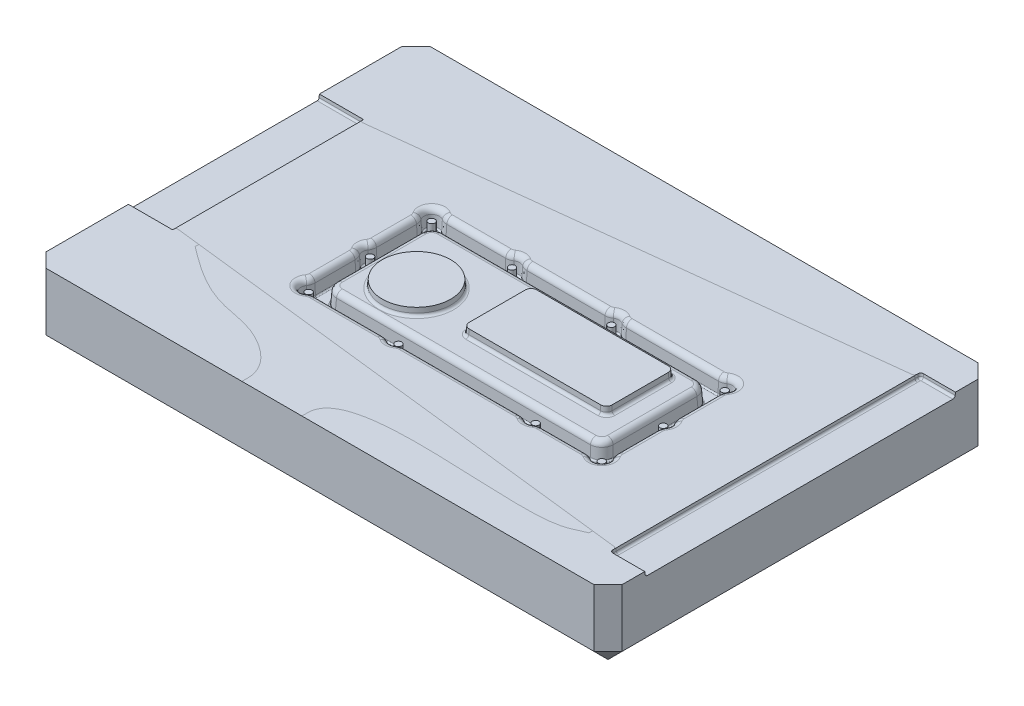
SolidWorks part; units mm, degrees
ref_plane "Front Plane" through (0, 0, 0) normal (0, 0, 1) x (1, 0, 0)
ref_plane "Top Plane" through (0, 0, 0) normal (0, 1, 0) x (1, 0, 0)
ref_plane "Right Plane" through (0, 0, 0) normal (1, 0, 0) x (0, 0, -1)
sketch "Sketch1" plane through (0, 0, 0) normal (0, 1, 0) x (1, 0, 0)
  line L5 (-304.8, 203.2) -> (304.8, 203.2)
  line L6 (-304.8, 203.2) -> (-304.8, -203.2)
  line L7 (-304.8, -203.2) -> (304.8, -203.2)
  line L8 (304.8, 203.2) -> (304.8, -203.2)
  line L9 (-304.8, 203.2) -> (304.8, -203.2) construction
  line L10 (-304.8, -203.2) -> (304.8, 203.2) construction
  point P0 (0, 0)
  dimension "D1" = 406.4
  dimension "D2" = 609.6
extrude "Boss-Extrude1" add sketch "Sketch1" against normal blind 76.2
sketch "Sketch4" plane through (0, 0, 0) normal (0, 1, 0) x (1, 0, 0)
  line L1 (152.0862, 42.0476) -> (-123.5031, 42.0476)
  line L2 (152.0862, 42.0476) -> (152.0862, -68.9356)
  line L3 (152.0862, -68.9356) -> (-123.5031, -68.9356)
  line L4 (-123.5031, 42.0476) -> (-123.5031, -68.9356)
extrude "Boss-Extrude2" add sketch "Sketch4" along normal blind 10
other "Cavity1"
other "die_demo_2020-2<3>@die_demo-a2"
sketch "Sketch5" plane through (0, 10, 0) normal (0, 1, 0) x (1, 0, 0)
  line L4 (152.0862, -68.9356) -> (152.0862, 42.0476)
  line L5 (152.0862, 42.0476) -> (-123.5031, 42.0476)
  line L6 (-123.5031, 42.0476) -> (-123.5031, -68.9356)
  line L7 (-123.5031, -68.9356) -> (152.0862, -68.9356)
  line L8 (152.0862, -68.9356) -> (152.0862, 42.0476)
  line L9 (152.0862, 42.0476) -> (-123.5031, 42.0476)
  line L10 (-123.5031, 42.0476) -> (-123.5031, -68.9356)
  line L11 (-123.5031, -68.9356) -> (152.0862, -68.9356)
  dimension "D1" = 0
extrude "Cut-Extrude3" cut sketch "Sketch5" against normal up to surface (2 mm away)
sketch "Sketch2" plane through (-270, 0, 0) normal (1, 0, 0) x (0, 0, -1)
  line L7 (-101.0245, 0) -> (-100.6872, -3.2091)
  line L8 (-98.6982, -5) -> (98.6982, -5)
  line L9 (100.6872, -3.2091) -> (101.0245, 0)
  line L10 (101.0245, 0) -> (98.318, 0)
  line L11 (91.6098, 0) -> (3.3541, 0)
  line L12 (-3.3541, 0) -> (-91.6098, 0)
  line L13 (-98.318, 0) -> (-101.0245, 0)
  line L21 (-101.0245, 0) -> (-100.6872, -3.2091)
  line L22 (-98.6982, -5) -> (98.6982, -5)
  line L23 (100.6872, -3.2091) -> (101.0245, 0)
  line L24 (101.0245, 0) -> (98.318, 0)
  line L25 (91.6098, 0) -> (3.3541, 0)
  line L26 (-3.3541, 0) -> (-91.6098, 0)
  line L27 (-98.318, 0) -> (-101.0245, 0)
  arc A5 (-100.6872, -3.2091) -> (-98.6982, -5) centre (-98.6982, -3) ccw
  arc A6 (98.6982, -5) -> (100.6872, -3.2091) centre (98.6982, -3) ccw
  arc A7 (91.6098, 0) -> (98.318, 0) centre (94.9639, 1) ccw
  arc A8 (-3.3541, 0) -> (3.3541, 0) centre (0, 1) ccw
  arc A9 (-98.318, 0) -> (-91.6098, 0) centre (-94.9639, 1) ccw
  arc A15 (-100.6872, -3.2091) -> (-98.6982, -5) centre (-98.6982, -3) ccw
  arc A16 (98.6982, -5) -> (100.6872, -3.2091) centre (98.6982, -3) ccw
  arc A17 (91.6098, 0) -> (98.318, 0) centre (94.9639, 1) ccw
  arc A18 (-3.3541, 0) -> (3.3541, 0) centre (0, 1) ccw
  arc A19 (-98.318, 0) -> (-91.6098, 0) centre (-94.9639, 1) ccw
  dimension "D1" = 0
extrude "Cut-Extrude1" cut sketch "Sketch2" against normal blind 60 contours M47 M36 M37 M38 M39 M40 M41 M42 M43 M44 M45 M46
sketch "Sketch3" plane through (280, 0, 0) normal (-1, 0, 0) x (0, 0, 1)
  line L8 (164.3338, 0) -> (161.6273, 0)
  line L9 (154.9191, 0) -> (68.3541, 0)
  line L10 (61.6459, 0) -> (-61.6459, 0)
  line L11 (-68.3541, 0) -> (-154.9191, 0)
  line L12 (-161.6273, 0) -> (-164.3338, 0)
  line L13 (-164.3338, 0) -> (-164.0436, -2.7613)
  line L14 (-161.5573, -5) -> (161.5573, -5)
  line L15 (164.0436, -2.7613) -> (164.3338, 0)
  line L24 (164.3338, 0) -> (161.6273, 0)
  line L25 (154.9191, 0) -> (68.3541, 0)
  line L26 (61.6459, 0) -> (-61.6459, 0)
  line L27 (-68.3541, 0) -> (-154.9191, 0)
  line L28 (-161.6273, 0) -> (-164.3338, 0)
  line L29 (-164.3338, 0) -> (-164.0436, -2.7613)
  line L30 (-161.5573, -5) -> (161.5573, -5)
  line L31 (164.0436, -2.7613) -> (164.3338, 0)
  arc A6 (154.9191, 0) -> (161.6273, 0) centre (158.2732, 1) ccw
  arc A7 (61.6459, 0) -> (68.3541, 0) centre (65, 1) ccw
  arc A8 (-68.3541, 0) -> (-61.6459, 0) centre (-65, 1) ccw
  arc A9 (-161.6273, 0) -> (-154.9191, 0) centre (-158.2732, 1) ccw
  arc A10 (-164.0436, -2.7613) -> (-161.5573, -5) centre (-161.5573, -2.5) ccw
  arc A11 (161.5573, -5) -> (164.0436, -2.7613) centre (161.5573, -2.5) ccw
  arc A18 (154.9191, 0) -> (161.6273, 0) centre (158.2732, 1) ccw
  arc A19 (61.6459, 0) -> (68.3541, 0) centre (65, 1) ccw
  arc A20 (-68.3541, 0) -> (-61.6459, 0) centre (-65, 1) ccw
  arc A21 (-161.6273, 0) -> (-154.9191, 0) centre (-158.2732, 1) ccw
  arc A22 (-164.0436, -2.7613) -> (-161.5573, -5) centre (-161.5573, -2.5) ccw
  arc A23 (161.5573, -5) -> (164.0436, -2.7613) centre (161.5573, -2.5) ccw
  dimension "D1" = 0
extrude "Cut-Extrude2" cut sketch "Sketch3" against normal blind 60 contours L24 A18 L25 A19 L26 A20 L27 A21 L28 L29 A22 L30 A23 L31
chamfer "Chamfer1" distance 15 angle 45 8 edges at (-304.8, -76.2, 0) (-304.8, -38.1, 203.2) (0, -76.2, 203.2) (-304.8, -38.1, -203.2) (0, -76.2, -203.2) (304.8, -38.1, -203.2) (304.8, -76.2, 0) (304.8, -38.1, 203.2)
sketch "Sketch13" plane through (0, 0, 0) normal (0, 1, 0) x (1, 0, 0)
  line L0 (-255.7716, -97.6031) -> (265.3426, -157.5873) construction
  line L1 (265.3426, 157.5873) -> (-255.7716, 97.6031) construction
  line L2 (-255.7716, -97.6031) -> (265.3426, -157.5873)
  line L3 (265.3426, 157.5873) -> (-255.7716, 97.6031)
  spline S0 degree 3 poles (-1691.2168, -560.7926) (38.1341, -243.9598) (271.9375, -181.7518) (267.9179, -159.8505) (267.8687, -159.6738) (267.7385, -159.3316) (267.6588, -159.1686) (267.4709, -158.8585) (267.3614, -158.7099) (267.1188, -158.4373) (266.9865, -158.3134) (266.7002, -158.09) (266.5444, -157.9899) (266.2216, -157.822) (266.054, -157.7533) (253.3346, -153.8451) (204.6173, -230.1108) (2080.1221, -995.018) knots -15.109264 -15.109264 -15.109264 -15.109264 0.125 0.125 0.25 0.25 0.375 0.375 0.5 0.5 0.625 0.625 0.75 0.75 0.875 0.875 9.891109 9.891109 9.891109 9.891109 only from (268, -160.5718) to (265.3426, -157.5873) construction
  spline S1 degree 3 poles (-94.1245, -2090.8167) (-207.2388, -335.3362) (-238.2471, -95.866) (-256.3313, -97.6127) (-256.4714, -97.6413) (-256.739, -97.7264) (-256.8671, -97.7825) (-257.1121, -97.9221) (-257.2273, -98.0052) (-257.4359, -98.1916) (-257.5313, -98.2968) (-257.6976, -98.5245) (-257.7677, -98.6455) (-257.8824, -98.9017) (-257.9267, -99.0377) (-261.7255, -116.857) (-26.9288, -175.1093) (1703.7131, -487.7406) knots -15.973473 -15.973473 -15.973473 -15.973473 0.125 0.125 0.25 0.25 0.375 0.375 0.5 0.5 0.625 0.625 0.75 0.75 0.875 0.875 17.019612 17.019612 17.019612 17.019612 only from (-255.7716, -97.6031) to (-258, -99.5927) construction
  spline S2 degree 3 poles (-258, 99.5927) (-258, 98.3101) (-257.044, 97.4566) (-255.7716, 97.6031) knots 0 0 0 0 1 1 1 1 weights 1 0.777005 0.777005 1 construction
  spline S3 degree 3 poles (265.3426, 157.5873) (266.934, 157.7705) (268, 158.9678) (268, 160.5718) knots 0 0 0 0 1 1 1 1 weights 1 0.830927 0.830927 1 construction
  spline S4 degree 3 poles (268, -160.5718) (268, -160.388) (267.9833, -160.207) (267.9179, -159.8505) (267.8687, -159.6738) (267.7385, -159.3316) (267.6588, -159.1686) (267.4709, -158.8585) (267.3614, -158.7099) (267.1188, -158.4373) (266.9865, -158.3134) (266.7002, -158.09) (266.5444, -157.9899) (266.2216, -157.822) (266.054, -157.7533) (265.7061, -157.6464) (265.5252, -157.6084) (265.3426, -157.5873) knots 0 0 0 0 0.125 0.125 0.25 0.25 0.375 0.375 0.5 0.5 0.625 0.625 0.75 0.75 0.875 0.875 1 1 1 1
  spline S5 degree 3 poles (-255.7716, -97.6031) (-255.9125, -97.5868) (-256.0527, -97.5858) (-256.3313, -97.6127) (-256.4714, -97.6413) (-256.739, -97.7264) (-256.8671, -97.7825) (-257.1121, -97.9221) (-257.2273, -98.0052) (-257.4359, -98.1916) (-257.5313, -98.2968) (-257.6976, -98.5245) (-257.7677, -98.6455) (-257.8824, -98.9017) (-257.9267, -99.0377) (-257.9851, -99.3115) (-258, -99.4508) (-258, -99.5927) knots 0 0 0 0 0.125 0.125 0.25 0.25 0.375 0.375 0.5 0.5 0.625 0.625 0.75 0.75 0.875 0.875 1 1 1 1
  spline S6 degree 3 poles (-258, 99.5927) (-258, 98.3101) (-257.044, 97.4566) (-255.7716, 97.6031) knots 0 0 0 0 1 1 1 1 weights 1 0.777005 0.777005 1
  spline S7 degree 3 poles (265.3426, 157.5873) (266.934, 157.7705) (268, 158.9678) (268, 160.5718) knots 0 0 0 0 1 1 1 1 weights 1 0.830927 0.830927 1
sketch "Sketch15" plane through (0, 0, 0) normal (0, 1, 0) x (1, 0, 0)
  line L7 (226.2155, -164.3248) -> (239.6707, -158.4928)
  line L8 (-19.05, -266.7) -> (-19.05, -196.85)
  line L9 (-82.55, -196.85) -> (-82.55, -266.7)
  line L10 (-230.9768, -104.3176) -> (-219.1986, -113.0541)
  line L11 (-230.5382, -100.5076) -> (-230.9768, -104.3176)
  line L12 (240.1092, -154.6828) -> (-230.5382, -100.5076)
  line L13 (239.6707, -158.4928) -> (240.1092, -154.6828)
  line L14 (226.2155, -164.3248) -> (239.6707, -158.4928)
  line L15 (-19.05, -266.7) -> (-19.05, -196.85)
  line L16 (-82.55, -196.85) -> (-82.55, -266.7)
  line L17 (-230.9768, -104.3176) -> (-219.1986, -113.0541)
  line L18 (-230.5382, -100.5076) -> (-230.9768, -104.3176)
  line L19 (240.1092, -154.6828) -> (-230.5382, -100.5076)
  line L20 (239.6707, -158.4928) -> (240.1092, -154.6828)
  arc A1 (-82.55, -266.7) -> (-19.05, -266.7) centre (-50.8, -266.7) ccw
  arc A2 (-82.55, -266.7) -> (-19.05, -266.7) centre (-50.8, -266.7) ccw
  spline S2 degree 3 poles (2624.0664, -1606.732) (-387.0128, -194.3356) (345.1945, -112.4347) (466.155, -271.9801) (-2098.6598, 1729.2076) knots -1.247582 -1.247582 -1.247582 -1.247582 0.454809 3.126416 3.126416 3.126416 3.126416 only from (-19.05, -196.85) to (226.2155, -164.3248)
  spline S3 degree 3 poles (-2038.958, 2269.9034) (-152.5444, -378.8888) (-284.4955, 111.0704) (160.8858, -432.7363) (-3046.2524, -589.6811) knots -1.618452 -1.618452 -1.618452 -1.618452 0.662842 2.440815 2.440815 2.440815 2.440815 only from (-219.1986, -113.0541) to (-82.55, -196.85)
  spline S4 degree 3 poles (-19.05, -196.85) (-19.05, -167.2577) (108.4908, -164.2778) (204.0825, -173.918) (226.2155, -164.3248) knots 0 0 0 0 0.454809 1 1 1 1
  spline S5 degree 3 poles (-219.1986, -113.0541) (-165.9874, -152.5237) (-141.7874, -133.3598) (-82.55, -176.9335) (-82.55, -196.85) knots 0 0 0 0 0.662842 1 1 1 1
  dimension "D1" = 0
